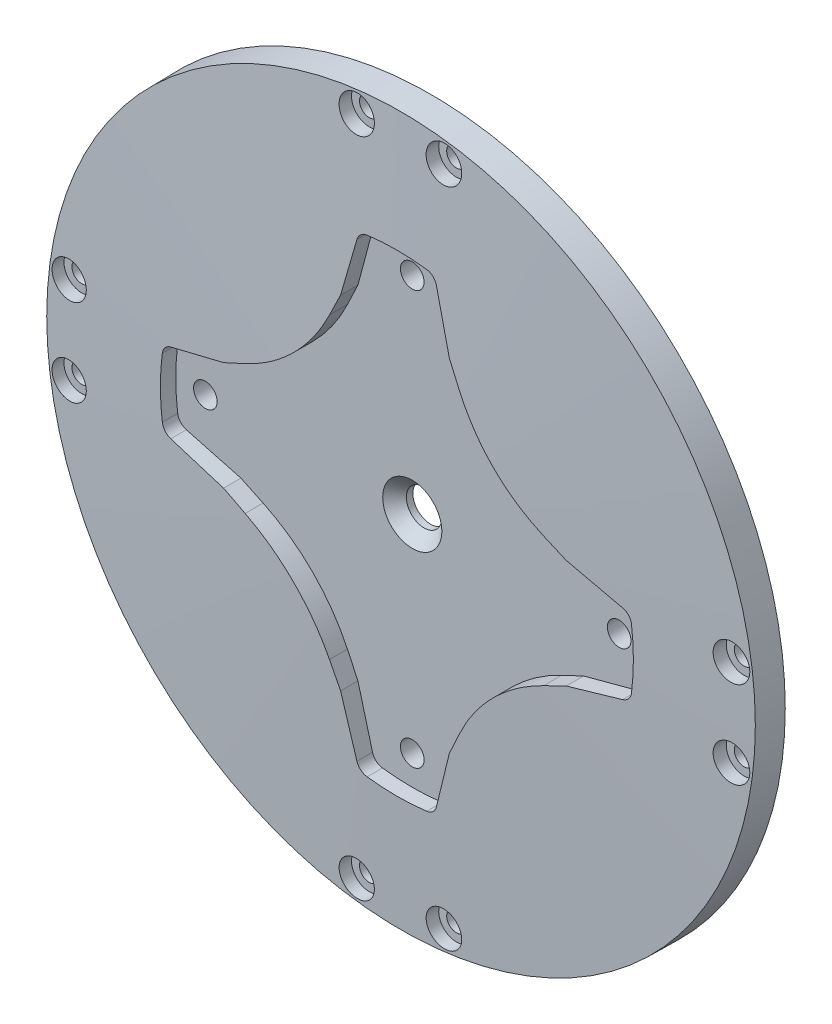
SolidWorks part; units mm, degrees
ref_plane "Front Plane" through (0, 0, 0) normal (0, 0, 1) x (1, 0, 0)
ref_plane "Top Plane" through (0, 0, 0) normal (0, 1, 0) x (1, 0, 0)
ref_plane "Right Plane" through (0, 0, 0) normal (1, 0, 0) x (0, 0, -1)
sketch "Sketch2" plane through (20.6586, 80.6094, -41) normal (0, -1, 0) x (1, 0, 0)
  line L0 (-60, 41) -> (-60, 79.7317) construction
  line L1 (-60, 41) -> (-59.9345, 46)
  line L2 (0, 41) -> (0, 78.5411) construction
  line L3 (18.0831, 41) -> (-18.0831, 41) construction
  line L4 (-59.9345, 46) -> (0, 48.093)
  line L6 (-60, 41) -> (0, 41)
  line L7 (0, 41) -> (0, 48.093)
  dimension "D1" = 0.75
  dimension "D2" = 5
  dimension "D3" = 2
  dimension "D4" = 7.093
revolve "Revolve1" add sketch "Sketch2" angle 360 about L2
sketch "Sketch3" plane through (0, 0, 0) normal (0, 0, -1) x (-1, 0, 0)
  circle A0 centre (-28.0333, 24.5928) radius 1.65
  circle A1 centre (-13.2839, 24.5928) radius 1.65
  circle A2 centre (-76.6752, 87.9841) radius 1.65
  circle A3 centre (-76.6752, 73.2347) radius 1.65
  circle A4 centre (-13.2839, 136.626) radius 1.65
  circle A5 centre (-28.0333, 136.626) radius 1.65
  circle A6 centre (35.358, 73.2347) radius 1.65
  circle A7 centre (35.358, 87.9841) radius 1.65
  point P21 (-20.6586, 80.6094)
  dimension "D1" = 3.3
  dimension "D2" = 3.3
  dimension "D3" = 4
extrude "Cut-Extrude2" cut sketch "Sketch3" against normal through all
ref_plane "Plane1" through (0, 0, 3) normal (0, 0, -1) x (-1, 0, 0)
sketch "Sketch5" plane through (0, 0, 3) normal (0, 0, -1) x (-1, 0, 0)
  circle A2 centre (-13.2839, 136.626) radius 3
  circle A12 centre (-28.0333, 136.626) radius 3
  dimension "D1" = 6
  dimension "D2" = 6
extrude "Cut-Extrude3" cut sketch "Sketch5" against normal through all
pattern_circular "CirPattern2" count 4 over 360 about axis through (20.6586, 80.6094, 0) along (0, 0, 1) of "Cut-Extrude3"
ref_plane "Plane2" through (0, 0, 7.1) normal (0, 0, -1) x (-1, 0, 0)
sketch "Sketch6" plane through (0, 0, 7.1) normal (0, 0, -1) x (-1, 0, 0)
  line L0 (-20.6586, 80.6094) -> (-20.6586, 140.5439) construction
  line L1 (-20.6586, 80.6094) -> (21.7215, 122.9895) construction
  line L2 (-20.6586, 80.6094) -> (39.2759, 80.6094) construction
  line L3 (-20.6586, 80.6094) -> (21.7215, 38.2293) construction
  line L4 (-20.6586, 80.6094) -> (-20.6586, 20.6748) construction
  line L5 (-20.6586, 80.6094) -> (-63.0387, 38.2293) construction
  line L6 (-20.6586, 80.6094) -> (-80.5931, 80.6094) construction
  line L7 (-20.6586, 80.6094) -> (-63.0387, 122.9895) construction
  line L8 (-29.851, 109.6008) -> (-49.65, 89.8018) construction
  line L9 (-29.851, 109.6008) -> (-27.0384, 120.0973)
  line L10 (-49.65, 89.8018) -> (-60.1465, 86.9892)
  line L11 (8.3328, 89.8018) -> (18.8293, 86.9892)
  line L12 (8.3328, 89.8018) -> (-11.4662, 109.6008) construction
  line L13 (-11.4662, 109.6008) -> (-14.2788, 120.0973)
  line L14 (-11.4662, 51.618) -> (-14.2788, 41.1215)
  line L15 (-11.4662, 51.618) -> (8.3328, 71.417) construction
  line L16 (8.3328, 71.417) -> (18.8293, 74.2296)
  line L17 (-49.65, 71.417) -> (-60.1465, 74.2296)
  line L18 (-49.65, 71.417) -> (-29.851, 51.618) construction
  line L19 (-29.851, 51.618) -> (-27.0384, 41.1215)
  line L20 (-49.65, 89.8018) -> (-45.8979, 91.5791)
  line L21 (-31.6283, 105.8486) -> (-29.851, 109.6008)
  line L22 (4.5807, 91.5791) -> (8.3328, 89.8018)
  line L23 (-11.4662, 109.6008) -> (-9.6889, 105.8486)
  line L24 (-9.6889, 55.3701) -> (-11.4662, 51.618)
  line L25 (8.3328, 71.417) -> (4.5807, 69.6397)
  line L26 (-45.8979, 69.6397) -> (-49.65, 71.417)
  line L27 (-29.851, 51.618) -> (-31.6283, 55.3701)
  circle A7 centre (-20.6586, 80.6094) radius 40
  circle A8 centre (-20.6586, 80.6094) radius 59.9345 construction
  arc A9 (-31.6283, 105.8486) -> (-45.8979, 91.5791) centre (-58.7404, 118.6912) cw
  arc A10 (4.5807, 91.5791) -> (-9.6889, 105.8486) centre (17.4232, 118.6912) cw
  arc A11 (-9.6889, 55.3701) -> (4.5807, 69.6397) centre (17.4232, 42.5275) cw
  arc A12 (-45.8979, 69.6397) -> (-31.6283, 55.3701) centre (-58.7404, 42.5275) cw
  point P14 (-20.6586, 80.6094)
  point P16 (-39.7505, 99.7013)
  point P33 (-20.6586, 80.6094)
  point P34 (-36.2149, 96.1657)
  point P55 (-20.6586, 80.6094)
  dimension "D1" = 80
  dimension "D10" = 30
  dimension "D2" = 8
  dimension "D3" = 45
  dimension "D4" = 15
  dimension "D5" = 15
  dimension "D6" = 27
  dimension "D7" = 28
  dimension "D9" = 5
  dimension "D8" = 4
extrude "Cut-Extrude4" cut sketch "Sketch6" along normal blind 4 contours L13 A7 L9 L8 L10 L17 L18 L19 L14 L15 L16 L11 L12
fillet "Fillet1" radius 2 8 edges at (60.1465, 86.9892, 4.3981) (60.1465, 74.2296, 4.3981) (-18.8293, 74.2296, 4.3981) (27.0384, 41.1215, 4.3981) (14.2788, 41.1215, 4.3981) (-18.8293, 86.9892, 4.3981) (14.2788, 120.0973, 4.3981) (27.0384, 120.0973, 4.3981)
sketch "Sketch7" plane through (0, 0, 3.1) normal (0, 0, 1) x (1, 0, 0)
  line L0 (20.6586, 120.6094) -> (20.6586, 106.3114) construction
  circle A1 centre (55.6586, 80.6094) radius 2
  arc A2 (25.6998, 120.2904) -> (15.6174, 120.2904) centre (20.6586, 80.6094) ccw construction
  arc A3 (-1.9969, 68.4717) -> (43.3141, 68.4717) centre (20.6586, 80.6094) ccw construction
  circle A4 centre (20.6586, 115.6094) radius 2
  circle A5 centre (20.6586, 45.6094) radius 2
  circle A6 centre (-14.3414, 80.6094) radius 2
  point P20 (20.6586, 80.6094)
  dimension "D1" = 4
  dimension "D2" = 5
extrude "Cut-Extrude5" cut sketch "Sketch7" against normal through all
sketch "Sketch8" plane through (0, 0, 3.1) normal (0, 0, 1) x (1, 0, 0)
  circle A0 centre (20.6586, 80.6094) radius 3
  dimension "D1" = 6
extrude "Cut-Extrude6" cut sketch "Sketch8" against normal through all
chamfer "Chamfer1" distance 2 angle 45 1 edges at (23.6586, 80.6094, 3.1)
equation "\"deg\"=2"
